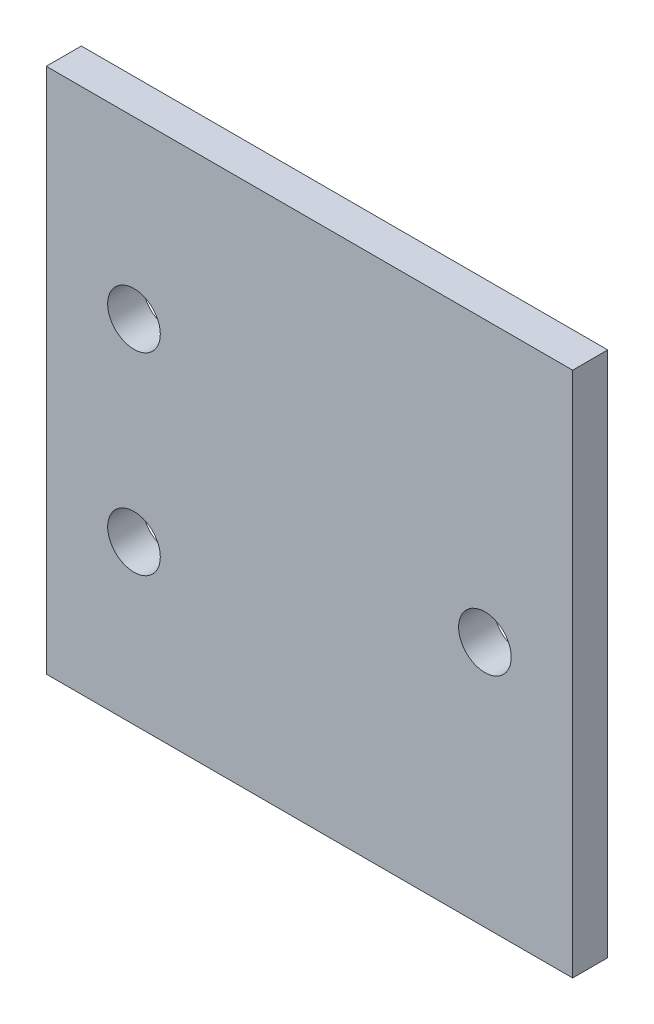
SolidWorks part; units mm, degrees
ref_plane "Front" through (0, 0, 0) normal (0, 0, 1) x (1, 0, 0)
ref_plane "Top" through (0, 0, 0) normal (0, 1, 0) x (1, 0, 0)
ref_plane "Right" through (0, 0, 0) normal (1, 0, 0) x (0, 0, -1)
sketch "Sketch1" plane through (0, 0, 0) normal (0, 0, 1) x (1, 0, 0)
  line L5 (0, 0) -> (30, 0)
  line L6 (0, 0) -> (0, -30)
  line L7 (0, -30) -> (30, -30)
  line L8 (30, 0) -> (30, -30)
  circle A3 centre (5, -9.9722) radius 1.5
  circle A4 centre (5, -20.9722) radius 1.5
  circle A5 centre (25, -15.9244) radius 1.5
  point P4 (5, -9.1469)
  point P11 (25, -11.6411)
  point P13 (5, -20.9722)
  point P14 (0, 0)
  dimension "D7" = 3
  dimension "D9" = 5
  dimension "D5" = 3
  dimension "D6" = 3
  dimension "D1" = 30
  dimension "D2" = 30
  dimension "D3" = 11
  dimension "D10" = 5
  dimension "D11" = 5
extrude "Boss-Extrude2" add sketch "Sketch1" along normal blind 2
